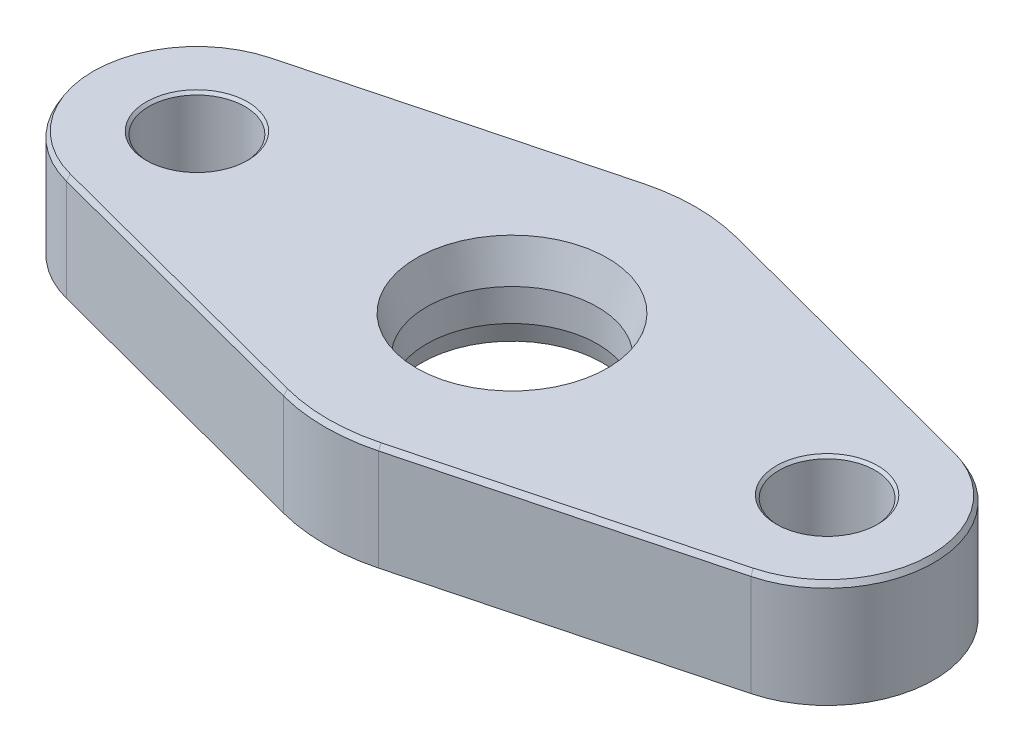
SolidWorks part; units mm, degrees
ref_plane "Face" through (0, 0, 0) normal (0, 0, 1) x (1, 0, 0)
ref_plane "Dessus" through (0, 0, 0) normal (0, 1, 0) x (1, 0, 0)
ref_plane "Profil" through (0, 0, 0) normal (1, 0, 0) x (0, 0, -1)
sketch "Esquisse1" plane through (0, 0, 0) normal (0, 1, 0) x (1, 0, 0)
  line L0 (-66.5608, 0) -> (66.5608, 0) construction
  line L1 (0, 26.9511) -> (0, -26.9511) construction
  line L2 (32.0424, -9.6714) -> (4.4492, -16.925)
  line L3 (-32.0424, 9.6714) -> (-4.4492, 16.925)
  line L4 (-32.0424, -9.6714) -> (-4.4492, -16.925)
  line L5 (32.0424, 9.6714) -> (4.4492, 16.925)
  arc A0 (-4.4492, 16.925) -> (4.4492, 16.925) centre (0, 0) cw
  arc A1 (-4.4492, -16.925) -> (4.4492, -16.925) centre (0, 0) ccw
  arc A2 (-32.0424, 9.6714) -> (-32.0424, -9.6714) centre (-29.5, 0) ccw
  arc A3 (32.0424, 9.6714) -> (32.0424, -9.6714) centre (29.5, 0) cw
  dimension "D1" = 17.5
  dimension "D4" = 10
  dimension "D3" = 29.5
extrude "Base-Extrusion" add sketch "Esquisse1" along normal blind 10
sketch "Esquisse2" plane through (0, 10, 0) normal (0, 1, 0) x (-1, 0, 0)
  circle A0 centre (0, 0) radius 8
  dimension "D1" = 16
extrude "Enlèv. mat.-Extru.1" cut sketch "Esquisse2" against normal through all
chamfer "Chanfrein2" distance 0.5 angle 30
chamfer "Chanfrein3" distance 3.5 angle 15
sketch "Esquisse7" plane through (0, 0, 0) normal (0, 0, 1) x (1, 0, 0)
  line L0 (0, 18.7165) -> (0, -10.7165) construction
  line L1 (0, -2.3152) -> (0, 4)
  line L2 (0, 4) -> (23.5686, -2.3152)
  line L3 (23.5686, -2.3152) -> (0, -2.3152)
  line L4 (-4.4492, 0) -> (4.4492, 0) construction
  dimension "D1" = 75
  dimension "D2" = 4
revolve "Enlèvement de matière-Révolution1" cut sketch "Esquisse7" angle 360 about L0
hole_wizard "Perçage1" positions "Esquisse6" profile "Esquisse5" hole size "M8" standard "ISO"
sketch "Esquisse6" plane through (0, 10, 0) normal (0, 1, 0) x (-1, 0, 0)
  arc A0 (32.0424, -9.6714) -> (32.0424, 9.6714) centre (29.5, 0) ccw construction
  point P0 (29.5, 0)
sketch "Esquisse5" plane through (-29.5, 10, 0) normal (1, 0, 0) x (0, 0, 1)
  line L0 (0, 0) -> (0, 10)
  line L1 (0, 10) -> (4.75, 10)
  line L2 (4.5, 9.75) -> (4.5, 0.25)
  line L3 (4.5, 0.25) -> (4.75, 0)
  line L5 (4.75, 0) -> (0, 0)
  line L6 (-4.5, 0.25) -> (-4.75, 0) construction
  line L7 (4.75, 10) -> (4.5, 9.75)
  line L8 (-4.75, 10) -> (-4.5, 9.75) construction
  line L11 (0, -6.35) -> (0, 107.95) construction
  dimension "Diamètre du perçage jusqu'au prochain" = 9
  dimension "Profondeur du perçage jusqu'au prochain" = 10
  dimension "Diamètre du fraisage entrant" = 9.5
  dimension "Angle du fraisage entrant" = 90
  dimension "Diamètre du fraisage débouchant" = 9.5
  dimension "Angle du fraisage débouchant" = 90
pattern_circular "Répétition circulaire1" count 2 over 360
sketch "Esquisse8" plane through (0, 10, 0) normal (0, 1, 0) x (-1, 0, 0)
  line L0 (0, 0) -> (-42.4264, 0)
  line L1 (0, 0) -> (30, -30)
  arc A0 (30, -30) -> (-42.4264, 0) centre (0, 0) cw
  dimension "D1" = 135
extrude "Coupe" cut sketch "Esquisse8" against normal through all
